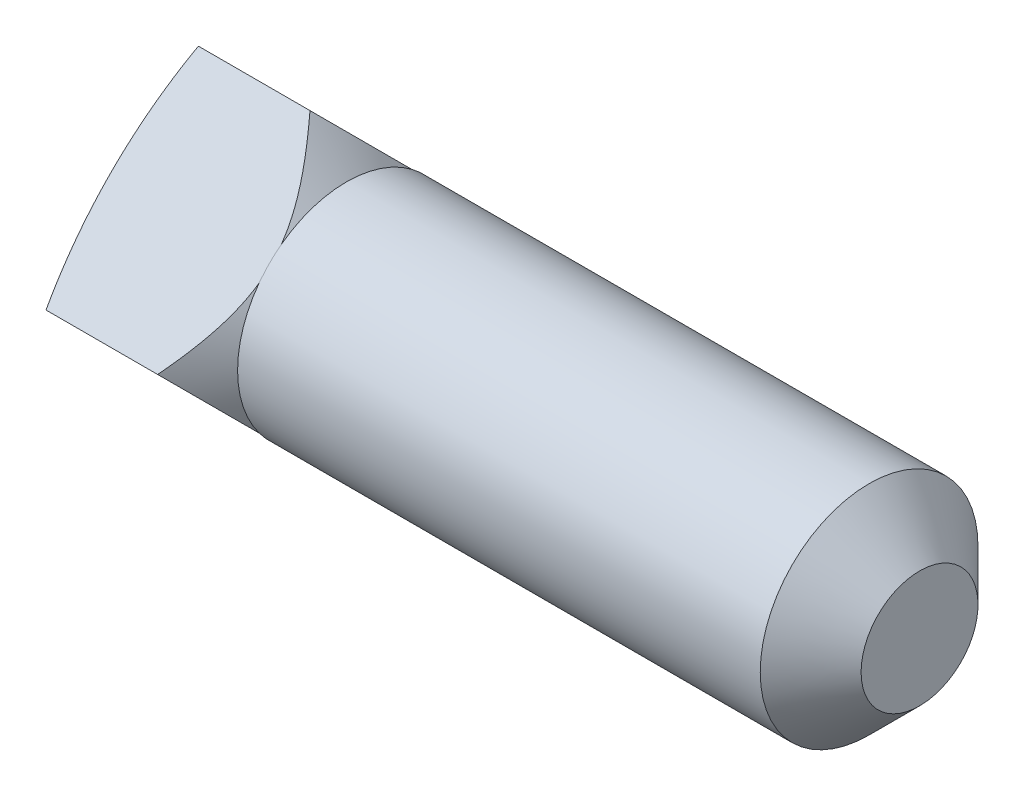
SolidWorks part; units mm, degrees
ref_plane "Plane1" through (0, 0, 0) normal (0, 0, 1) x (1, 0, 0)
ref_plane "Plane2" through (0, 0, 0) normal (0, 1, 0) x (1, 0, 0)
ref_plane "Plane3" through (0, 0, 0) normal (1, 0, 0) x (0, 0, -1)
sketch "BodySke" plane through (0, 0, 0) normal (0, 0, 1) x (1, 0, 0)
  line L0 (2.5522, -2.413) -> (11.5824, -2.413) construction
  line L1 (0, 0) -> (0, 2.413)
  line L2 (0, 2.413) -> (11.5824, 2.413)
  line L3 (12.7, 0) -> (12.7, 1.2954)
  line L4 (12.7, 0) -> (0, 0)
  line L5 (-12.7, 0) -> (88.9, 0) construction
  line L6 (11.5824, 2.413) -> (12.7, 1.2954)
  line L7 (11.5824, -2.413) -> (12.7, -1.2954) construction
  line L8 (0.7874, 3.175) -> (0.7874, -1.2954) construction
  line L9 (0, 3.175) -> (0, -1.2954) construction
  dimension "Length" = 12.7
  dimension "Diameter" = 4.826
  dimension "Nose_ch_ang" = 45
  dimension "Flat_dia" = 2.5908
  dimension "Advance" = 0.7874
  dimension "Thread_nom" = 12.7
revolve "BaseBody" add sketch "BodySke"
pattern_linear "ThdSchPat" [suppressed]
revolve "ThreadSchematic" cut sketch "ThdSchSke" angle 360 about L5
sketch "ThdSchSke" plane through (0, 0, 0) normal (0, 0, 1) x (1, 0, 0)
  line L0 (0.7874, -1.9406) -> (0.4566, -2.413)
  line L1 (0.7874, -1.9406) -> (1.1182, -2.413)
  line L2 (1.1182, -2.413) -> (1.1182, -3.0163)
  line L3 (-3.175, 0) -> (5.1513, 0) construction
  line L5 (1.1182, -3.0163) -> (0.4566, -3.0163)
  line L6 (0.4566, -3.0163) -> (0.4566, -2.413)
  dimension "D1" = 360
  dimension "Thread_minor" = 3.8811
  dimension "D2" = 1
  dimension "Diameter" = 4.826
  dimension "Start" = 0.7874
  dimension "D4" = 50
  dimension "SideAngle" = 55
  dimension "VeeAngle" = 70
  dimension "Overcut" = 6.0325
  dimension "Num_threads" = 15
  dimension "Advance" = 0.7711
sketch "Sketch4" plane through (0, 0, 0) normal (-1, 0, 0) x (0, -0.7071, 0.7071)
  line L1 (-2.3876, -2.3876) -> (2.3876, -2.3876)
  line L2 (-2.3876, -2.3876) -> (-2.3876, 2.3876)
  line L3 (-2.3876, 2.3876) -> (2.3876, 2.3876)
  line L4 (2.3876, -2.3876) -> (2.3876, 2.3876)
  dimension "D1" = 4.7752
  dimension "Width_flats" = 4.7752
  dimension "D2" = 2.3876
  dimension "D3" = 2.3876
extrude "BaseHead" add sketch "Sketch4" along normal blind 3.7592
sketch "Sketch5" plane through (0, 0, 0) normal (0, 0, 1) x (1, 0, 0)
  line L0 (-3.7592, 0) -> (-16.4592, 0)
  line L1 (0, 0) -> (57.15, 0) construction
  line L2 (-12.7, 0) -> (88.9, 0) construction
  line L3 (-16.4592, 0) -> (-16.4592, 3.3766)
  line L5 (-16.4592, 3.3766) -> (-3.2823, 3.3766)
  line L6 (-3.7592, 3.3766) -> (0, 3.3766) construction
  arc A0 (-3.2823, 3.3766) -> (-3.7592, 0) centre (8.4328, 0) ccw
  dimension "Head_radius" = 12.192
  dimension "D2" = 8.4328
  dimension "D3" = 12.7
revolve "HeadCrown" cut sketch "Sketch5" angle 360 about L1
sketch "Sketch6" plane through (0, 0, 0) normal (0, 0, 1) x (1, 0, 0)
  line L0 (0, 2.413) -> (-0.8085, 3.3766)
  line L1 (0, 1.9352) -> (0, 3.3766) construction
  line L2 (0, 2.413) -> (12.7, 2.413)
  line L3 (12.7, 2.413) -> (12.7, 16.0766)
  line L5 (-0.8085, 3.3766) -> (-0.8085, 16.0766)
  line L6 (-0.8085, 16.0766) -> (12.7, 16.0766)
  line L7 (-3.2823, 3.3766) -> (0, 3.3766) construction
  line L9 (0, 0) -> (60.325, 0) construction
  dimension "D1" = 12.7
  dimension "D2" = 12.7
  dimension "D3" = 40
  dimension "D4" = 2.413
revolve "HeadChamfer1" cut sketch "Sketch6" angle 360 about L9
equation "\"D1@Sketch4\" = \"Width_flats@Sketch4\""
equation "\"D2@Sketch4\" = \"Width_flats@Sketch4\" / 2"
equation "\"D3@Sketch4\" = \"Width_flats@Sketch4\" / 2"
equation "\"D2@Sketch5\" = \"Head_radius@Sketch5\" - \"Head_ht@BaseHead\""
equation "\"Thread_length@ThreadCosmetic\" = ((sgn( (\"Length@BodySke\" - \"Advance@BodySke\" - ( ( ( \"Diameter@BodySke\" - \"Flat_dia@BodySke\" ) * 0.5 ) * tan( \"Nose_ch_ang@BodySke\" * 0.017453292 ) ) ) - \"Thread_nom@B"
equation "\"Thread_minor@ThdSchSke\" = \"Thread_minor@ThreadCosmetic\""
equation "\"Diameter@ThdSchSke\" = \"Diameter@BodySke\""
equation "\"Overcut@ThdSchSke\" = \"Diameter@BodySke\" * 1.25"
equation "\"Start@ThdSchSke\" = (\"Length@BodySke\" - ( ( ( \"Diameter@BodySke\" - \"Flat_dia@BodySke\" ) * 0.5 ) * tan( \"Nose_ch_ang@BodySke\" * 0.017453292 ) ) ) - \"Thread_length@ThreadCosmetic\"  '---Non-countersunk--"
equation "\"Num_threads@ThdSchPat\" = int( \"Thread_length@ThreadCosmetic\" / \"Advance@BodySke\" + 0.999 )  + 1"
equation "\"Advance@ThdSchPat\" = \"Thread_length@ThreadCosmetic\" /  (\"Num_threads@ThdSchPat\" - 1) 'relax it"
equation "' \"Num_threads@ThdSchPat\" = \"Num_threads@ThdSchPat\" - sgn( \"Num_threads@ThdSchPat\" - 1) '---chamfered tips only---"
equation "\"D4@Sketch6\" = \"Diameter@BodySke\" / 2.0"
